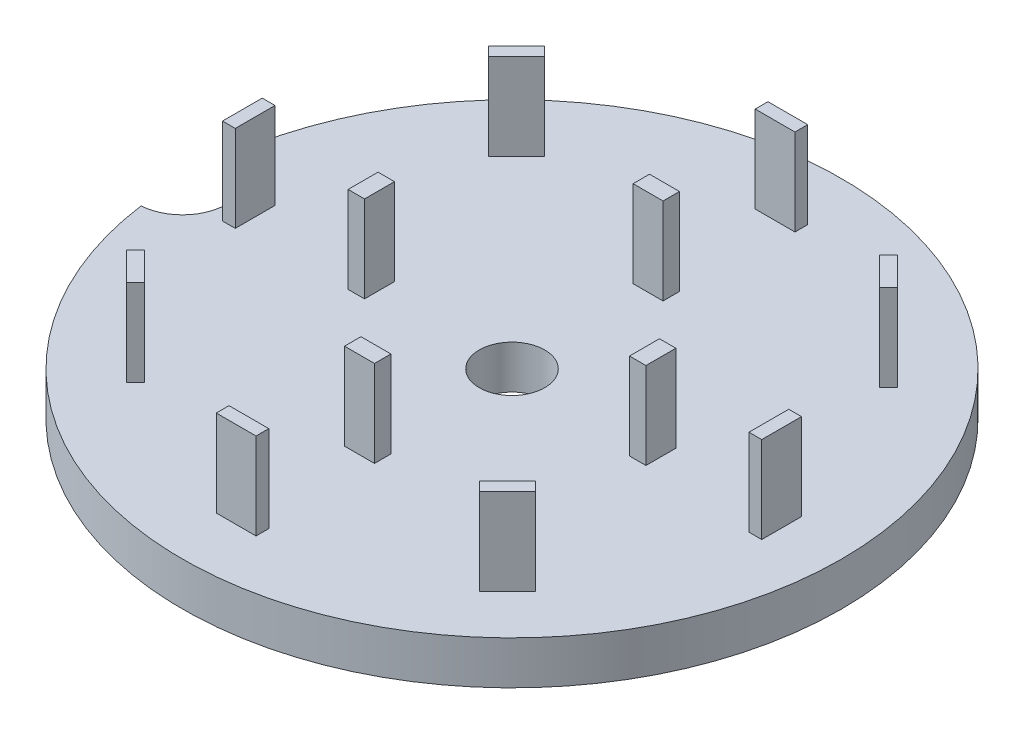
SolidWorks part; units mm, degrees
ref_plane "Front Plane" through (0, 0, 0) normal (0, 0, 1) x (1, 0, 0)
ref_plane "Top Plane" through (0, 0, 0) normal (0, 1, 0) x (1, 0, 0)
ref_plane "Right Plane" through (0, 0, 0) normal (1, 0, 0) x (0, 0, -1)
sketch "Sketch1" plane through (0, 0, 0) normal (0, 1, 0) x (1, 0, 0)
  arc A0 (-15.0839, -2.0496) -> (-15.0839, 2.0496) centre (0, 0) ccw
  arc A1 (-15.0839, -2.0496) -> (-15.0839, 2.0496) centre (-15.2225, 0) ccw
extrude "Boss-Extrude1" add sketch "Sketch1" along normal blind 2
sketch "Sketch2" plane through (0, 2, 0) normal (0, 1, 0) x (-1, 0, 0)
  circle A0 centre (0, 0) radius 1.5127
extrude "Cut-Extrude1" cut sketch "Sketch2" against normal blind 2
sketch "Sketch3" plane through (0, 2, 0) normal (0, 1, 0) x (-1, 0, 0)
  line L10 (-6.9612, -0.6089) -> (-6.9612, 0.7744)
  line L11 (0.6089, -6.9612) -> (-0.7744, -6.9612)
  line L12 (0.6089, -6.9612) -> (0.6089, -6.2026)
  line L13 (0.6089, -6.2026) -> (-0.7744, -6.2026)
  line L14 (-0.7744, -6.9612) -> (-0.7744, -6.2026)
  line L15 (-6.9612, -0.6089) -> (-6.2026, -0.6089)
  line L16 (-6.2026, -0.6089) -> (-6.2026, 0.7744)
  line L17 (-6.9612, 0.7744) -> (-6.2026, 0.7744)
  line L18 (-0.6089, 6.9612) -> (0.7744, 6.9612)
  line L19 (-0.6089, 6.9612) -> (-0.6089, 6.2026)
  line L20 (-0.6089, 6.2026) -> (0.7744, 6.2026)
  line L21 (0.7744, 6.9612) -> (0.7744, 6.2026)
  line L22 (6.9612, 0.6089) -> (6.9612, -0.7744)
  line L23 (6.9612, 0.6089) -> (6.2026, 0.6089)
  line L24 (6.2026, 0.6089) -> (6.2026, -0.7744)
  line L25 (6.9612, -0.7744) -> (6.2026, -0.7744)
  line L26 (-8.3604, -9.4556) -> (-7.9436, -9.0388)
  line L27 (0.7744, -12.5978) -> (-1.0623, -12.5978)
  line L28 (0.7744, -12.5978) -> (0.7744, -12.0084)
  line L29 (0.7744, -12.0084) -> (-1.0623, -12.0084)
  line L30 (-1.0623, -12.5978) -> (-1.0623, -12.0084)
  line L31 (-8.3604, -9.4556) -> (-9.6592, -8.1568)
  line L32 (-9.6592, -8.1568) -> (-9.2424, -7.74)
  line L33 (-7.9436, -9.0388) -> (-9.2424, -7.74)
  line L34 (-12.5978, -0.7744) -> (-12.0084, -0.7744)
  line L35 (-12.5978, -0.7744) -> (-12.5978, 1.0623)
  line L36 (-12.5978, 1.0623) -> (-12.0084, 1.0623)
  line L37 (-12.0084, -0.7744) -> (-12.0084, 1.0623)
  line L38 (-9.4556, 8.3604) -> (-9.0388, 7.9436)
  line L39 (-9.4556, 8.3604) -> (-8.1568, 9.6592)
  line L40 (-8.1568, 9.6592) -> (-7.74, 9.2424)
  line L41 (-9.0388, 7.9436) -> (-7.74, 9.2424)
  line L42 (-0.7744, 12.5978) -> (-0.7744, 12.0084)
  line L43 (-0.7744, 12.5978) -> (1.0623, 12.5978)
  line L44 (1.0623, 12.5978) -> (1.0623, 12.0084)
  line L45 (-0.7744, 12.0084) -> (1.0623, 12.0084)
  line L46 (8.3604, 9.4556) -> (7.9436, 9.0388)
  line L47 (8.3604, 9.4556) -> (9.6592, 8.1568)
  line L48 (9.6592, 8.1568) -> (9.2424, 7.74)
  line L49 (7.9436, 9.0388) -> (9.2424, 7.74)
  line L50 (12.5978, 0.7744) -> (12.0084, 0.7744)
  line L51 (12.5978, 0.7744) -> (12.5978, -1.0623)
  line L52 (12.5978, -1.0623) -> (12.0084, -1.0623)
  line L53 (12.0084, 0.7744) -> (12.0084, -1.0623)
  line L54 (9.4556, -8.3604) -> (9.0388, -7.9436)
  line L55 (9.4556, -8.3604) -> (8.1568, -9.6592)
  line L56 (8.1568, -9.6592) -> (7.74, -9.2424)
  line L57 (9.0388, -7.9436) -> (7.74, -9.2424)
  dimension "D1" = 4
  dimension "D2" = 8
extrude "Boss-Extrude2" add sketch "Sketch3" along normal blind 4
